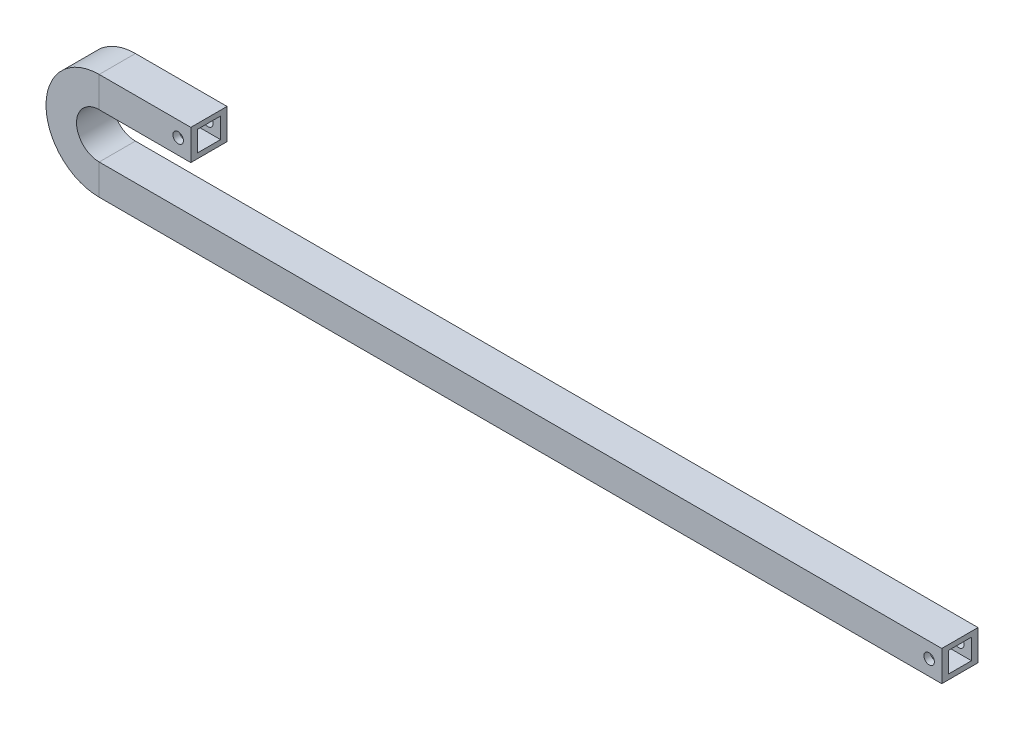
SolidWorks part; units mm, degrees
ref_plane "Aufriss" through (0, 0, 0) normal (0, 0, 1) x (1, 0, 0)
ref_plane "Grundriss" through (0, 0, 0) normal (0, 1, 0) x (1, 0, 0)
ref_plane "Seitenriss" through (0, 0, 0) normal (1, 0, 0) x (0, 0, -1)
sketch "Skizze1" plane through (0, 0, 0) normal (1, 0, 0) x (0, 0, -1)
  line L1 (-5.5, -4.85) -> (5.5, -4.85)
  line L2 (-5.5, -4.85) -> (-5.5, 4.85)
  line L3 (-5.5, 4.85) -> (5.5, 4.85)
  line L4 (5.5, -4.85) -> (5.5, 4.85)
  line L5 (-5.5, -4.85) -> (5.5, 4.85) construction
  line L6 (-5.5, 4.85) -> (5.5, -4.85) construction
  line L7 (-8.6, -7.25) -> (8.6, -7.25)
  line L8 (-8.6, -7.25) -> (-8.6, 7.25)
  line L9 (-8.6, 7.25) -> (8.6, 7.25)
  line L10 (8.6, -7.25) -> (8.6, 7.25)
  line L11 (-8.6, -7.25) -> (8.6, 7.25) construction
  line L12 (-8.6, 7.25) -> (8.6, -7.25) construction
  point P0 (0, 0)
  point P5 (0, 0)
  dimension "D1" = 11
  dimension "D2" = 9.7
  dimension "D3" = 14.5
  dimension "D4" = 17.2
sketch "Skizze3" plane through (0, 0, 0) normal (0, 0, 1) x (1, 0, 0)
  line L0 (0, 0) -> (-400, 0)
  line L1 (-400, 36) -> (-356.5, 36)
  arc A0 (-400, 0) -> (-400, 36) centre (-400, 18) cw
  dimension "D1" = 400
  dimension "D2" = 18
  dimension "D3" = 43.5
sweep "Austragung1" add profiles "Skizze1" path "Skizze3"
sketch "Skizze4" plane through (0, 0, 8.6) normal (0, 0, 1) x (1, 0, 0)
  line L0 (-6, 0) -> (0, 0) construction
  line L1 (-362.5, 36) -> (-356.5, 36) construction
  line L2 (-356.5, 28.75) -> (-356.5, 43.25) construction
  circle A0 centre (-362.5, 36) radius 2.5
  circle A1 centre (-6, 0) radius 2.5
  dimension "D1" = 6
  dimension "D2" = 5
extrude "Schnitt-Linear austragen1" cut sketch "Skizze4" against normal through all
